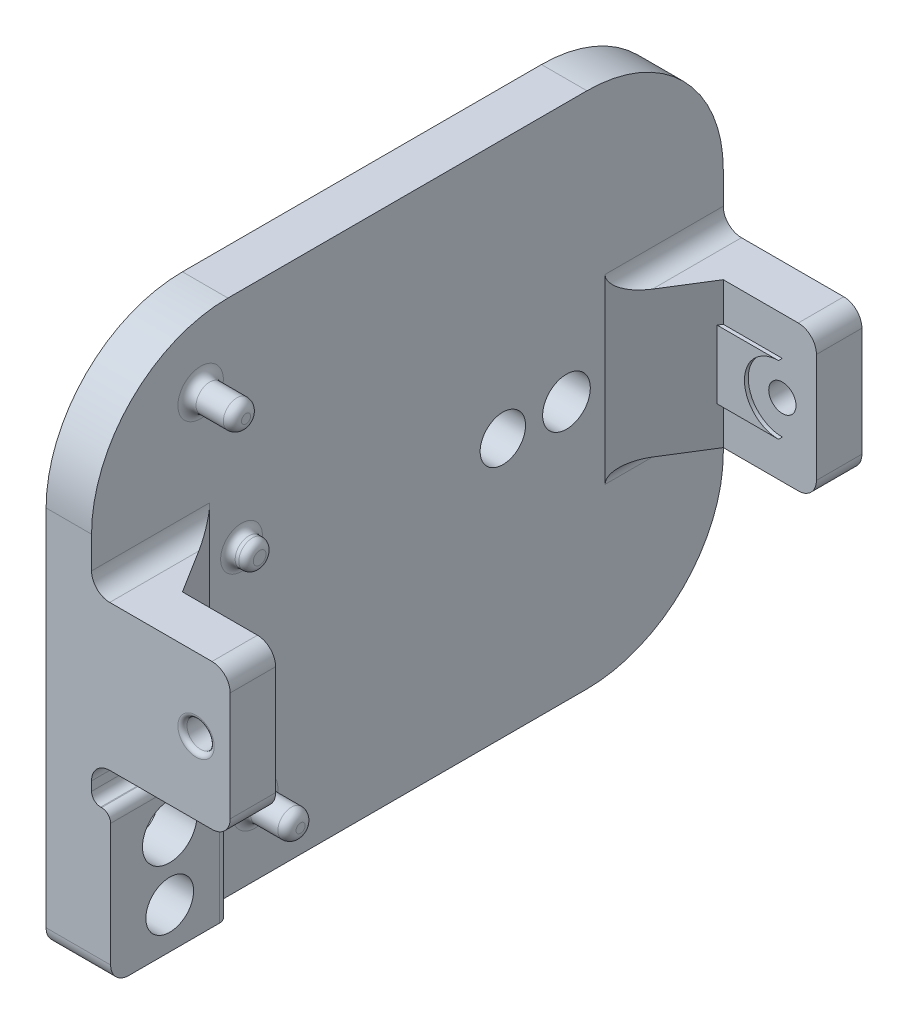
SolidWorks part; units mm, degrees
ref_plane "Front Plane" through (0, 0, 0) normal (1, 0, 0) x (0, 1, 0)
ref_plane "Top Plane" through (0, 0, 0) normal (0, 0, 1) x (0, 1, 0)
ref_plane "Right Plane" through (0, 0, 0) normal (0, 1, 0) x (-1, 0, 0)
sketch "Sketch1" plane through (0, 0, 0) normal (1, 0, 0) x (0, 1, 0)
  line L0 (28.5, 17.25) -> (28.5, 24.25) construction
  line L1 (0, 0) -> (57, 0)
  line L2 (0, 0) -> (0, 69.5)
  line L3 (0, 69.5) -> (57, 69.5)
  line L4 (57, 0) -> (57, 69.5)
  line L5 (11.5, 63) -> (4.5, 63) construction
  circle A1 centre (11.5, 63) radius 3
  circle A2 centre (28.5, 24.25) radius 2.5
  circle A5 centre (4.5, 63) radius 2.625
  circle A6 centre (28.5, 17.25) radius 2.625
  point P11 (28.5, 69.5)
  dimension "D3" = 6.5
  dimension "D4" = 6
  dimension "D6" = 45.25
  dimension "D7" = 5.25
  dimension "D9" = 5
  dimension "D1" = 69.5
  dimension "D2" = 57
  dimension "D5" = 17
  dimension "D8" = 24
extrude "Boss-Extrude1" add sketch "Sketch1" along normal blind 5
sketch "Sketch3" plane through (5, 0, 0) normal (1, 0, 0) x (0, 1, 0)
  line L0 (57, 69.5) -> (0, 69.5) construction
  line L1 (20.5, 69.5) -> (36.5, 69.5)
  line L2 (20.5, 69.5) -> (20.5, 64.5)
  line L3 (20.5, 64.5) -> (36.5, 64.5)
  line L4 (36.5, 69.5) -> (36.5, 64.5)
  point P6 (28.5, 69.5)
  point P7 (28.5, 64.5)
  dimension "D1" = 5
  dimension "D2" = 16
extrude "Boss-Extrude2" add sketch "Sketch3" along normal blind 15.25
sketch "Sketch4" plane through (0, 0, 64.5) normal (0, 0, -1) x (1, 0, 0)
  line L0 (20.25, -20.5) -> (20.25, -36.5) construction
  circle A0 centre (16.5, -28.5) radius 1.5
  point P4 (20.25, -28.5)
  dimension "D2" = 3
  dimension "D1" = 3.75
extrude "Cut-Extrude1" cut sketch "Sketch4" against normal through all
ref_plane "Plane1" through (0, 0, 34.75) normal (0, 0, -1) x (-1, 0, 0)
mirror "Mirror1" about plane through (0, 0, 34.75) normal (0, 0, -1) of "Cut-Extrude1", "Boss-Extrude2"
sketch "Sketch5" plane through (0, 0, 0) normal (-1, 0, 0) x (0, -1, 0)
  line L0 (-15.177, 66.677) -> (-7.823, 59.323) construction
  line L1 (-7.3988, 59.7473) -> (-8.2473, 58.8988)
  line L2 (-8.2473, 58.8988) -> (-15.6012, 66.2527)
  line L3 (-15.6012, 66.2527) -> (-14.7527, 67.1012)
  line L4 (-14.7527, 67.1012) -> (-7.3988, 59.7473)
  line L6 (0, 69.5) -> (0, 0) construction
  line L7 (-33.7, 24.25) -> (-23.3, 24.25) construction
  line L8 (-23.3, 23.65) -> (-23.3, 24.85)
  line L9 (-23.3, 24.85) -> (-33.7, 24.85)
  line L10 (-33.7, 24.85) -> (-33.7, 23.65)
  line L11 (-33.7, 23.65) -> (-23.3, 23.65)
  line L12 (0, 0) -> (-57, 0) construction
  circle A0 centre (-11.5, 63) radius 3 construction
  circle A1 centre (-28.5, 24.25) radius 2.5 construction
  point P4 (-11.5, 63)
  point P7 (-7.823, 59.323)
  point P18 (-28.5, 24.25)
  point P22 (-23.3, 24.25)
  dimension "D1" = 10.4
  dimension "D2" = 1.2
  dimension "D3" = 45
extrude "Cut-Extrude2" cut sketch "Sketch5" against normal blind 2
sketch "Sketch6" plane through (5, 0, 0) normal (1, 0, 0) x (0, 1, 0)
  line L0 (0, 69.5) -> (0, 0) construction
  line L1 (0, 69.5) -> (16.5, 69.5)
  line L2 (0, 69.5) -> (0, 56.5)
  line L3 (0, 56.5) -> (16.5, 56.5)
  line L4 (16.5, 69.5) -> (16.5, 56.5)
  line L6 (20.5, 69.5) -> (0, 69.5) construction
  circle A0 centre (11.5, 63) radius 3 construction
  circle A2 centre (11.5, 63) radius 3
  circle A4 centre (4.5, 63) radius 2.625
  circle A5 centre (4.5, 63) radius 2.625 construction
  point P6 (16.5, 63)
  dimension "D2" = 5
extrude "Boss-Extrude3" add sketch "Sketch6" along normal blind 2.1
sketch "Sketch13" plane through (5, 0, 0) normal (1, 0, 0) x (0, 1, 0)
  line L0 (36.5, 69.5) -> (20.5, 69.5) construction
  line L1 (20.5, 64.5) -> (36.5, 64.5) construction
  line L2 (20.5, 64.5) -> (36.5, 64.5) construction
  circle A0 centre (49.5, 57.5) radius 1.5
  circle A1 centre (7.5, 51.5) radius 1.5
  point P4 (28.5, 69.5)
  dimension "D1" = 3
  dimension "D2" = 21
  dimension "D3" = 7
  dimension "D4" = 13
  dimension "D5" = 21
extrude "Boss-Extrude5" add sketch "Sketch13" along normal blind 5
sketch "Sketch14" plane through (5, 0, 0) normal (1, 0, 0) x (0, 1, 0)
  line L0 (36.5, 69.5) -> (20.5, 69.5) construction
  circle A0 centre (32.5, 53) radius 1.5
  dimension "D2" = 3
  dimension "D1" = 16.5
extrude "Boss-Extrude6" add sketch "Sketch14" along normal blind 2
sketch "Sketch7" plane through (2, 0, 0) normal (-1, 0, 0) x (0, -1, 0)
  line L0 (-15.6012, 66.2527) -> (-8.2473, 58.8988)
  line L1 (-8.2473, 58.8988) -> (-7.3988, 59.7473)
  line L2 (-7.3988, 59.7473) -> (-14.7527, 67.1012)
  line L3 (-14.7527, 67.1012) -> (-15.6012, 66.2527)
extrude "Cut-Extrude3" cut sketch "Sketch7" against normal blind 1
sketch "Contour hex bolt precision screws - 2.1mm cut extrude" [suppressed] plane through (7.1, 0, 0) normal (1, 0, 0) x (0, 1, 0)
  line L0 (0, 69.5) -> (0, 56.5) construction
  line L1 (7.2, 64.8475) -> (4, 66.695)
  line L2 (4, 66.695) -> (0.8, 64.8475)
  line L3 (0.8, 64.8475) -> (0.8, 61.1525)
  line L4 (0.8, 61.1525) -> (4, 59.305)
  line L5 (4, 59.305) -> (7.2, 61.1525)
  line L6 (7.2, 61.1525) -> (7.2, 64.8475)
  circle A0 centre (4, 63) radius 3.2 construction
  dimension "D1" = 6.4
sketch "Contour hex bolt precision screw (2) - 2.1 mm cut extrude" [suppressed] plane through (5, 0, 0) normal (1, 0, 0) x (0, 1, 0)
  line L1 (29.3475, 14.55) -> (31.195, 17.75)
  line L2 (31.195, 17.75) -> (29.3475, 20.95)
  line L3 (29.3475, 20.95) -> (25.6525, 20.95)
  line L4 (25.6525, 20.95) -> (23.805, 17.75)
  line L5 (23.805, 17.75) -> (25.6525, 14.55)
  line L6 (25.6525, 14.55) -> (29.3475, 14.55)
  line L7 (35.5, 0) -> (19.5, 0) construction
  circle A0 centre (27.5, 17.75) radius 3.2 construction
  dimension "D1" = 6.4
fillet "Fillet1" radius 15 3 edges at (2.5, 57, 0) (2.5, 0, 0) (2.5, 57, 69.5)
chamfer "Chamfer1" distance 8 distance2 5 1 edges at (5, 28.5, 64.5)
chamfer "Chamfer2" distance 5 distance2 8 1 edges at (5, 28.5, 5)
fillet "Fillet3" radius 0.5 2 edges at (15, 28.5, 69.5) (15, 28.5, 0)
fillet "Fillet2" radius 2 9 edges at (5, 36.5, 6.5) (5, 20.5, 6.5) (5, 20.5, 63) (5, 36.5, 63) (20.25, 20.5, 2.5) (20.25, 36.5, 2.5) (20.25, 36.5, 67) (20.25, 20.5, 67) (3.55, 0, 69.5)
fillet "Fillet4" radius 1 9 edges at (7.1, 16.5, 63) (5, 16.5, 63) (7.1, 8.25, 56.5) (5, 8.25, 56.5) (6.05, 16.5, 56.5) (5, 49.5, 59) (10, 49.5, 56) (10, 7.5, 50) (5, 7.5, 53)
fillet "Fillet5" radius 0.8 2 edges at (7, 32.5, 51.5) (5, 32.5, 54.5)
sketch "Sketch8" plane through (0, 0, 64.5) normal (0, 0, -1) x (1, 0, 0)
  line L2 (9.5, -24.75) -> (16.5, -24.75)
  line L3 (9.5, -32.25) -> (16.5, -32.25)
  line L4 (9.5, -24.75) -> (9.5, -32.25)
  line L5 (10, -20.5) -> (10, -36.5) construction
  arc A0 (16.5, -24.75) -> (16.5, -32.25) centre (16.5, -28.5) ccw
  point P9 (16.5, -28.5)
  dimension "D1" = 3.75
  dimension "D2" = 0.5
extrude "Boss-Extrude4" add sketch "Sketch8" along normal blind 0.42
mirror "Mirror2" about plane through (0, 0, 34.75) normal (0, 0, -1) of "Boss-Extrude4"
